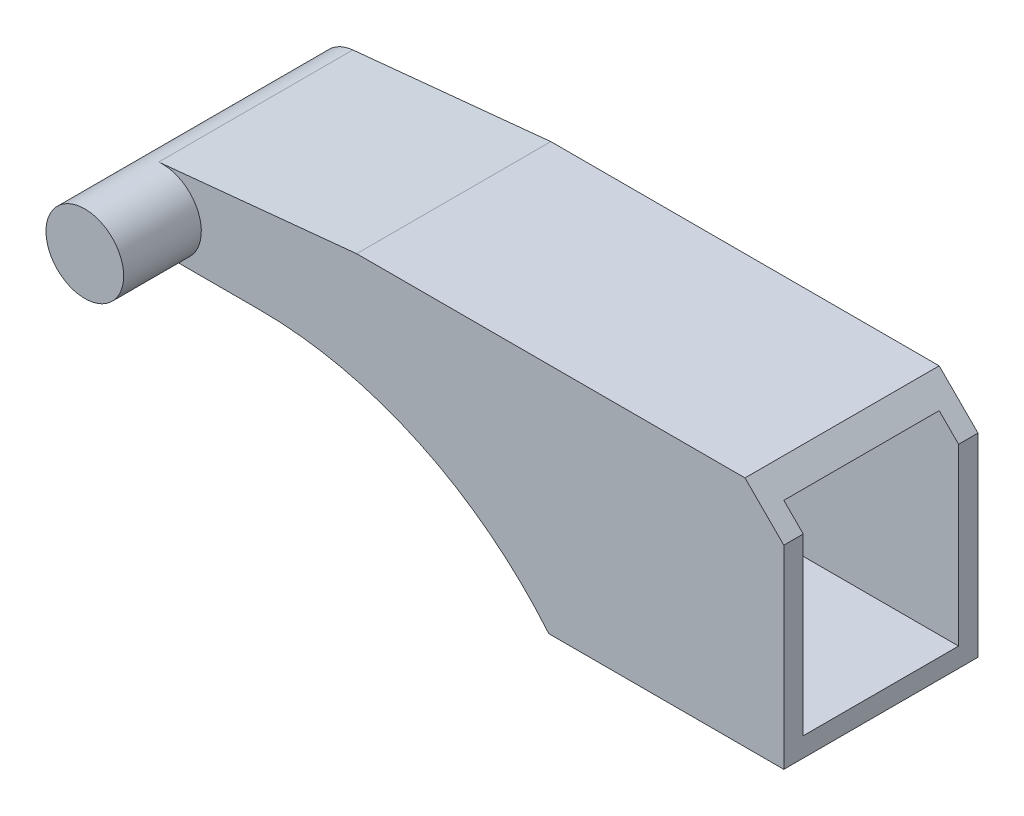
SolidWorks part; units mm, degrees
ref_plane "Plan1" through (0, 0, 0) normal (0, 0, 1) x (1, 0, 0)
ref_plane "Plan2" through (0, 0, 0) normal (0, 1, 0) x (1, 0, 0)
ref_plane "Plan3" through (0, 0, 0) normal (1, 0, 0) x (0, 0, -1)
sketch "Esquisse1" plane through (0, 0, 0) normal (0, 0, 1) x (1, 0, 0)
  line L0 (-16.5858, 24.5858) -> (-17.5858, 25.5858)
  line L1 (-17.5858, 25.5858) -> (-27.5858, 25.5858)
  line L2 (-16.5858, 24.5858) -> (-16.5858, 19.5858)
  line L3 (-16.5858, 19.5858) -> (-22.6385, 19.5858)
  line L4 (-27.5858, 25.5858) -> (-32.6843, 25.0809)
  line L5 (-32.5858, 23.0858) -> (-30.0858, 23.0858)
  arc A0 (-32.6843, 25.0809) -> (-32.5858, 23.0858) centre (-32.5858, 24.0858) ccw
  arc A1 (-22.6385, 19.5858) -> (-30.0858, 23.0858) centre (-30.0858, 13.4127) ccw
  dimension "D1" = 1
  dimension "D2" = 5
  dimension "D3" = 15
  dimension "D4" = 16
  dimension "D5" = 6
  dimension "D6" = 10
  dimension "D7" = 1.5
  dimension "D8" = 2.5
extrude "Base-Extrusion" add sketch "Esquisse1" along normal blind 5
shell "Coque1" thickness 0.5
sketch "Esquisse2" plane through (-16.5858, 0, 0) normal (1, 0, 0) x (0, 0, -1)
  line L0 (-5, 25.5858) -> (0, 25.5858) construction
  line L1 (-4.5, 23.8787) -> (-0.5, 23.8787)
  line L2 (-4.5, 23.8787) -> (-4.5, 25.0858)
  line L3 (-4.5, 25.0858) -> (-0.5, 25.0858)
  line L4 (-0.5, 23.8787) -> (-0.5, 25.0858)
  dimension "D1" = 0.5
extrude "Enlèv. mat.-Extru.1" cut sketch "Esquisse2" against normal blind 2
sketch "Esquisse3" plane through (0, 0, 5) normal (0, 0, 1) x (1, 0, 0)
  circle A0 centre (-32.5858, 24.0858) radius 1
  dimension "D1" = 2
extrude "Boss.-Extru.1" add sketch "Esquisse3" along normal blind 2
sketch "Esquisse4" plane through (0, 0, 0) normal (0, 0, -1) x (-1, 0, 0)
  line L0 (16.5858, 19.5858) -> (16.5858, 24.5858) construction
  line L1 (22.6385, 19.5858) -> (16.5858, 19.5858) construction
  circle A0 centre (19.5858, 22.5858) radius 1.5
  dimension "D3" = 3
  dimension "D1" = 3
  dimension "D2" = 3
extrude "Boss.-Extru.2" add sketch "Esquisse4" along normal blind 0.5
